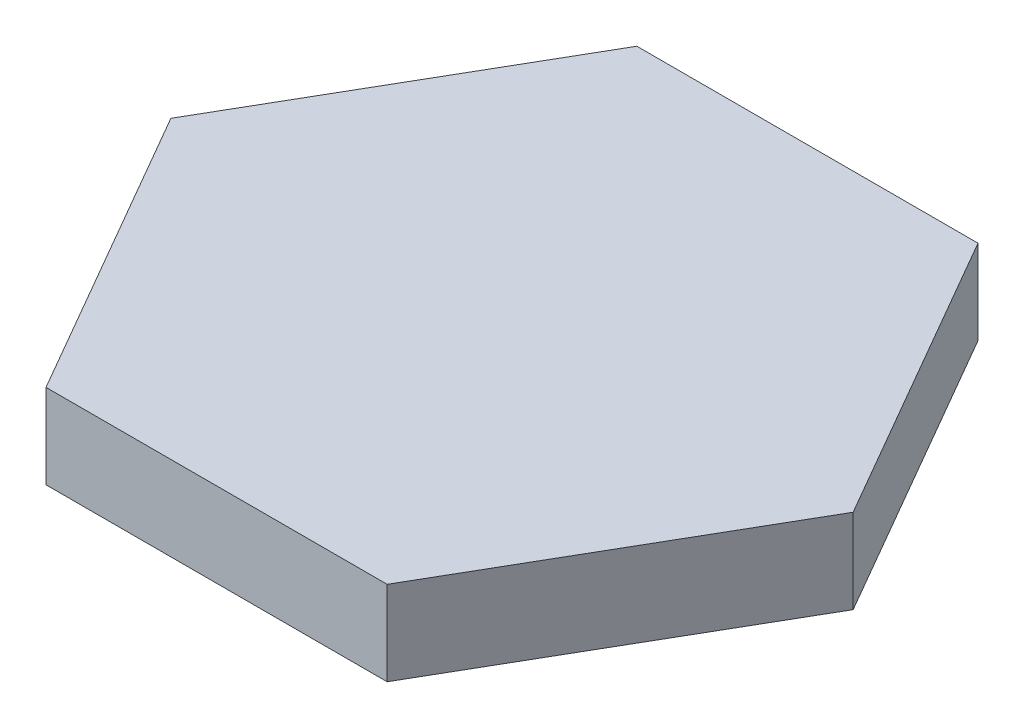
SolidWorks part; units mm, degrees
ref_plane "Front Plane" through (0, 0, 0) normal (0, 0, 1) x (1, 0, 0)
ref_plane "Top Plane" through (0, 0, 0) normal (0, 1, 0) x (1, 0, 0)
ref_plane "Right Plane" through (0, 0, 0) normal (1, 0, 0) x (0, 0, -1)
sketch "Sketch1" plane through (0, 0, 0) normal (0, 1, 0) x (1, 0, 0)
  line L1 (20.2073, -35) -> (40.4145, 0)
  line L2 (40.4145, 0) -> (20.2073, 35)
  line L3 (20.2073, 35) -> (-20.2073, 35)
  line L4 (-20.2073, 35) -> (-40.4145, 0)
  line L5 (-40.4145, 0) -> (-20.2073, -35)
  line L6 (-20.2073, -35) -> (20.2073, -35)
  circle A0 centre (0, 0) radius 35 construction
  dimension "D1" = 70
extrude "Boss-Extrude1" add sketch "Sketch1" along normal blind 10
